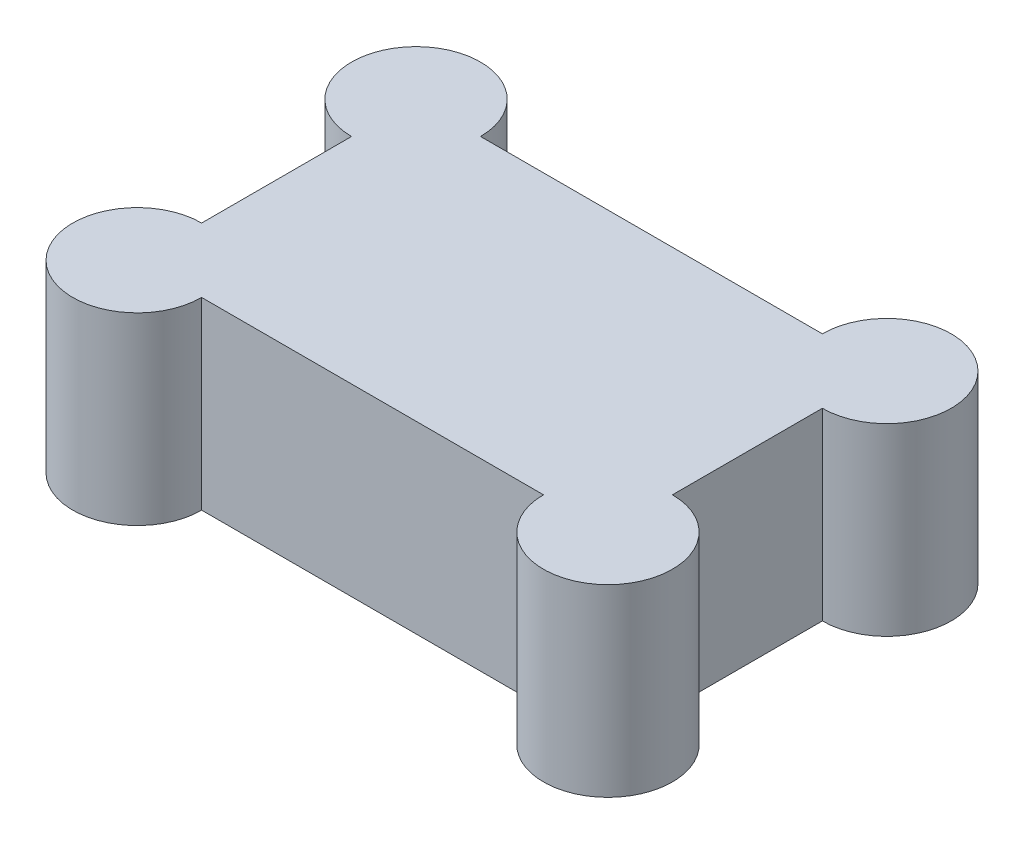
SolidWorks part; units mm, degrees
ref_plane "Front" through (0, 0, 0) normal (0, 0, 1) x (1, 0, 0)
ref_plane "Top" through (0, 0, 0) normal (0, 1, 0) x (1, 0, 0)
ref_plane "Right" through (0, 0, 0) normal (1, 0, 0) x (0, 0, -1)
sketch "Sketch1" plane through (0, 0, 0) normal (0, 1, 0) x (1, 0, 0)
  line L1 (-18.5535, 15.1363) -> (18.5535, 15.1363)
  line L2 (-25.5535, 8.1363) -> (-25.5535, -8.1363)
  line L3 (-18.5535, -15.1363) -> (18.5535, -15.1363)
  line L4 (25.5535, 8.1363) -> (25.5535, -8.1363)
  line L5 (-25.5535, 15.1363) -> (25.5535, -15.1363) construction
  line L6 (-25.5535, -15.1363) -> (25.5535, 15.1363) construction
  arc A0 (-25.5535, -8.1363) -> (-18.5535, -15.1363) centre (-25.5535, -15.1363) ccw
  arc A1 (18.5535, -15.1363) -> (25.5535, -8.1363) centre (25.5535, -15.1363) ccw
  arc A2 (-18.5535, 15.1363) -> (-25.5535, 8.1363) centre (-25.5535, 15.1363) ccw
  arc A3 (25.5535, 8.1363) -> (18.5535, 15.1363) centre (25.5535, 15.1363) ccw
  point P0 (0, 0)
  dimension "D2" = 14
  dimension "D3" = 14
  dimension "D4" = 14
  dimension "D5" = 14
  dimension "D1" = 59.4
extrude "Boss-Extrude1" add sketch "Sketch1" along normal blind 20 contours L2 A0 L3 A1 L4 A3 L1 A2
